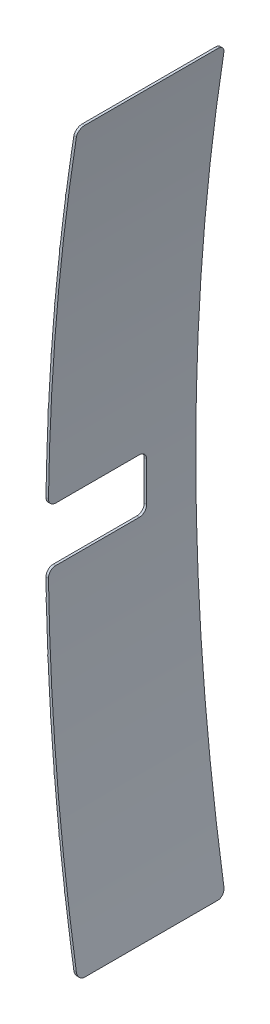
SolidWorks part; units mm, degrees
ref_plane "前视基准面" through (0, 0, 0) normal (0, 0, 1) x (1, 0, 0)
ref_plane "上视基准面" through (0, 0, 0) normal (0, 1, 0) x (1, 0, 0)
ref_plane "右视基准面" through (0, 0, 0) normal (1, 0, 0) x (0, 0, -1)
sketch "草图1" plane through (0, 0, 0) normal (0, 0, 1) x (1, 0, 0)
  line L0 (-93.9096, 15) -> (-93.8083, 15)
  line L1 (-93.9096, -15) -> (-93.8083, -15)
  line L2 (-1000, 0) -> (49000, 0) construction
  arc A0 (-93.9096, 15) -> (-93.9096, -15) centre (0, 0) ccw
  arc A1 (-93.8083, 15) -> (-93.8083, -15) centre (0, 0) ccw
  dimension "D1" = 190.2
  dimension "D2" = 190
  dimension "D3" = 30
extrude "凸台-拉伸1" add sketch "草图1" along normal blind 6
ref_plane "基准面1" through (-50, 0, 0) normal (1, 0, 0) x (0, 0, -1)
sketch "草图4" plane through (0, 0, 0) normal (1, 0, 0) x (0, 0, -1)
  line L0 (-6, -1.1) -> (-2, -1.1)
  line L1 (-6, 15) -> (-6, -15) construction
  line L2 (-2, -1.1) -> (-2, 1.1)
  line L3 (-2, 1.1) -> (-6, 1.1)
  line L4 (-6, 1.1) -> (-6, -1.1)
  line L5 (-1000, 0) -> (49000, 0) construction
  dimension "D1" = 4
  dimension "D2" = 2.2
extrude "切除-拉伸1" cut sketch "草图4" against normal through all
fillet "圆角1" radius 0.3 8 edges at (-93.8589, -15, 6) (-93.8589, -15, 0) (-93.8589, 15, 6) (-93.8589, 15, 0) (-95.0436, -1.1, 2) (-95.0436, 1.1, 2) (-95.0436, 1.1, 6) (-95.0436, -1.1, 6)
sketch "草图5" plane through (-50, 0, 0) normal (1, 0, 0) x (0, 0, -1)
  line L0 (0, -2.8572) -> (0, 3.1428)
  line L1 (0, 3.1428) -> (-2, 0.1428)
  line L2 (-2, 0.1428) -> (0, -2.8572)
  line L3 (-1002, 0.1428) -> (48998, 0.1428) construction
  line L4 (0, -14.7) -> (0, 14.7) construction
  line L5 (-2, 0.8) -> (-2, -0.8) construction
  line L6 (-6, -1.4) -> (-6, -14.7) construction
  line L7 (-6, -2.3) -> (-2, -2.3)
  line L8 (-6, -2.3) -> (-6, -2.1)
  line L9 (-6, -2.1) -> (-2, -2.1)
  line L10 (-2, -2.3) -> (-2, -2.1)
  line L11 (-6, -4.3) -> (-2, -4.3)
  line L12 (-6, -4.3) -> (-6, -4.1)
  line L13 (-6, -4.1) -> (-2, -4.1)
  line L14 (-2, -4.3) -> (-2, -4.1)
  line L15 (-6, -6.3) -> (-2, -6.3)
  line L16 (-6, -6.3) -> (-6, -6.1)
  line L17 (-6, -6.1) -> (-2, -6.1)
  line L18 (-2, -6.3) -> (-2, -6.1)
  line L19 (-6, -8.3) -> (-2, -8.3)
  line L20 (-6, -8.3) -> (-6, -8.1)
  line L21 (-6, -8.1) -> (-2, -8.1)
  line L22 (-2, -8.3) -> (-2, -8.1)
  line L23 (-6, -10.3) -> (-2, -10.3)
  line L24 (-6, -10.3) -> (-6, -10.1)
  line L25 (-6, -10.1) -> (-2, -10.1)
  line L26 (-2, -10.3) -> (-2, -10.1)
  line L27 (-6, -12.3) -> (-2, -12.3)
  line L28 (-6, -12.3) -> (-6, -12.1)
  line L29 (-6, -12.1) -> (-2, -12.1)
  line L30 (-2, -12.3) -> (-2, -12.1)
  line L31 (-5.7, -1.1) -> (-2.3, -1.1) construction
  line L32 (-2, 12.5855) -> (-2, 12.3855)
  line L33 (-6, 12.3855) -> (-2, 12.3855)
  line L34 (-6, 12.5855) -> (-6, 12.3855)
  line L35 (-6, 12.5855) -> (-2, 12.5855)
  line L36 (-2, 10.5855) -> (-2, 10.3855)
  line L37 (-6, 10.3855) -> (-2, 10.3855)
  line L38 (-6, 10.5855) -> (-6, 10.3855)
  line L39 (-6, 10.5855) -> (-2, 10.5855)
  line L40 (-2, 8.5855) -> (-2, 8.3855)
  line L41 (-6, 8.3855) -> (-2, 8.3855)
  line L42 (-6, 8.5855) -> (-6, 8.3855)
  line L43 (-6, 8.5855) -> (-2, 8.5855)
  line L44 (-2, 6.5855) -> (-2, 6.3855)
  line L45 (-6, 6.3855) -> (-2, 6.3855)
  line L46 (-6, 6.5855) -> (-6, 6.3855)
  line L47 (-6, 6.5855) -> (-2, 6.5855)
  line L48 (-2, 4.5855) -> (-2, 4.3855)
  line L49 (-6, 4.3855) -> (-2, 4.3855)
  line L50 (-6, 4.5855) -> (-6, 4.3855)
  line L51 (-6, 4.5855) -> (-2, 4.5855)
  line L52 (-2, 2.5855) -> (-2, 2.3855)
  line L53 (-6, 2.3855) -> (-2, 2.3855)
  line L54 (-6, 2.5855) -> (-6, 2.3855)
  line L55 (-6, 2.5855) -> (-2, 2.5855)
  dimension "D1" = 6
  dimension "D2" = 0.2
  dimension "D3" = 4
  dimension "D5" = 1
  dimension "D4" = 6
wrap "包覆1" sketch "草图5" wrap type emboss source sketch "草图5" thickness 0.01 parameters "D1"=0.01
